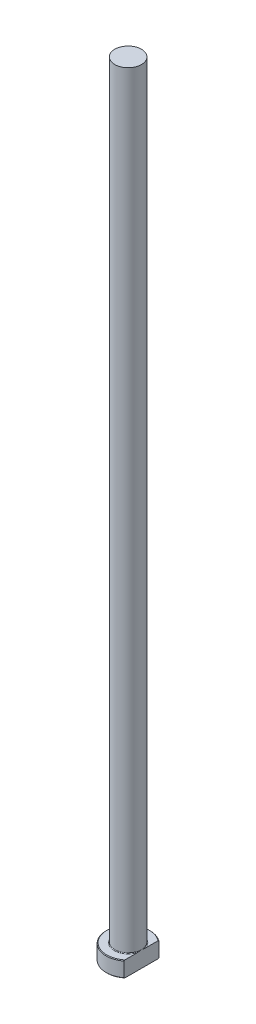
SolidWorks part; units mm, degrees
ref_plane "Front Plane" through (0, 0, 0) normal (0, 0, 1) x (1, 0, 0)
ref_plane "Top Plane" through (0, 0, 0) normal (0, 1, 0) x (1, 0, 0)
ref_plane "Right Plane" through (0, 0, 0) normal (1, 0, 0) x (0, 0, -1)
sketch "Sketch1" plane through (0, 0, 0) normal (0, 0, 1) x (1, 0, 0)
  line L0 (0, 259.9588) -> (0, -15.1925) construction
  line L1 (0, 0) -> (-7, 0)
  line L2 (-7, 0) -> (-7, 5)
  line L3 (-7, 5) -> (-4.25, 5)
  line L4 (-4.25, 5) -> (-4.25, 250)
  line L5 (-4.25, 250) -> (0, 250)
  line L6 (0, 250) -> (0, 0)
  dimension "L" = 250
  dimension "H" = 14
  dimension "T" = 5
  dimension "D" = 8.5
revolve "Revolve1" add sketch "Sketch1" angle 360 about L0
chamfer "Chamfer1" distance 0.2 angle 45 2 edges at (0, 5, 7) (0, 0, 7)
fillet "Fillet1" radius 0.2 1 edges at (0, 5, 4.25)
sketch "Sketch2" plane through (0, 0, 0) normal (0, 1, 0) x (1, 0, 0)
  line L0 (4.25, 5.5621) -> (4.25, -5.5621)
  circle A0 centre (0, 0) radius 7 construction
  arc A1 (4.25, -5.5621) -> (4.25, 5.5621) centre (0, 0) ccw
  circle A2 centre (0, 0) radius 4.25 construction
extrude "KEY" cut sketch "Sketch2" along normal through all
